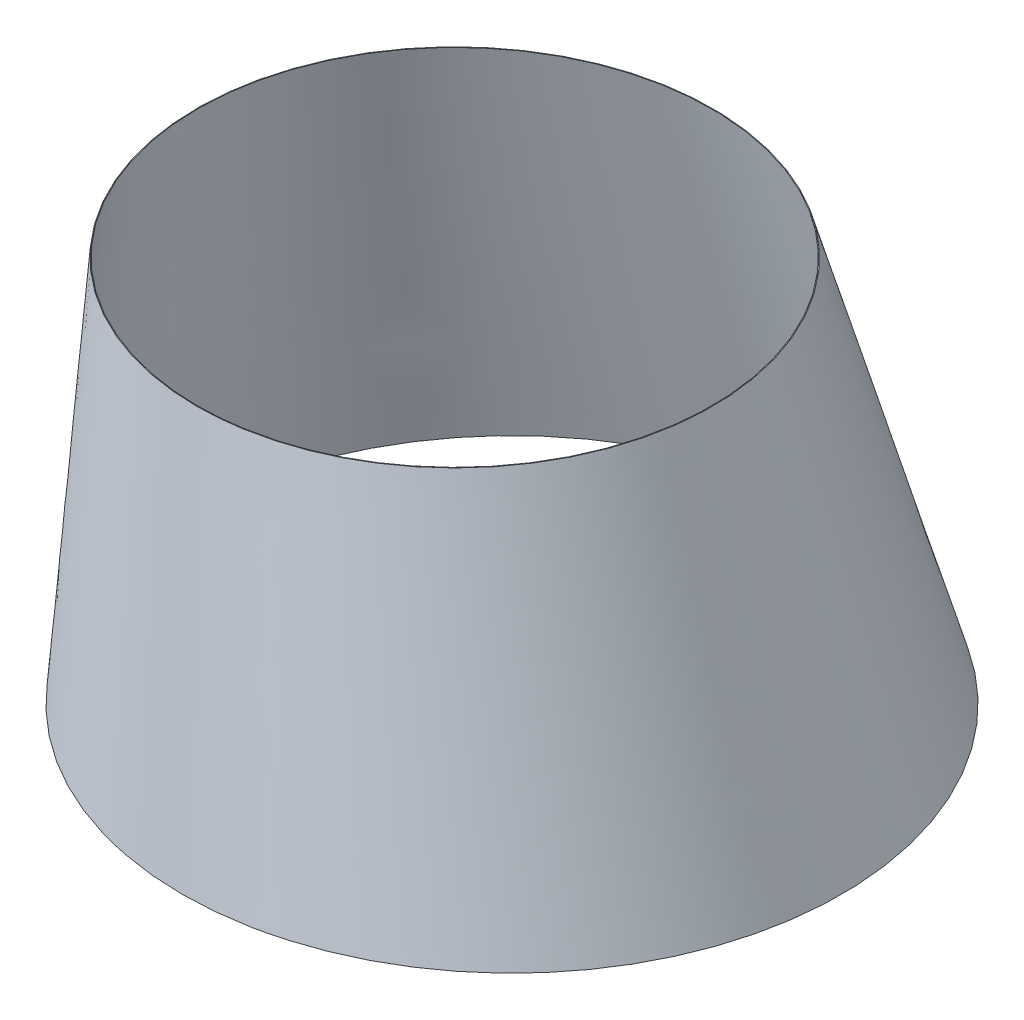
SolidWorks part; units mm, degrees
ref_plane "前视基准面" through (0, 0, 0) normal (0, 0, 1) x (1, 0, 0)
ref_plane "上视基准面" through (0, 0, 0) normal (0, 1, 0) x (1, 0, 0)
ref_plane "右视基准面" through (0, 0, 0) normal (1, 0, 0) x (0, 0, -1)
sketch "草图1" plane through (0, 0, 0) normal (0, 1, 0) x (1, 0, 0)
  line L0 (-460, 0) -> (460, 0) construction
  circle A0 centre (0, 0) radius 460
  dimension "D" = 920
sketch "草图2" plane through (0, 0, 0) normal (0, 0, 1) x (1, 0, 0)
  line L0 (-368, 2300) -> (-368, 0) construction
  line L1 (460, 0) -> (-368, 2300) construction
  line L2 (-368, 2300) -> (-460, 0) construction
  line L3 (-440, 500) -> (280, 500)
  line L4 (-80, 500) -> (-80, 0) construction
  line L5 (-460, 0) -> (460, 0) construction
  dimension "C" = 80
  dimension "d" = 720
  dimension "h" = 500
sketch "草图3" plane through (0, 0, 0) normal (0, 0, 1) x (1, 0, 0)
  point P0 (-368, 2300)
loft "放样1" add profiles "草图1", "草图3"
extrude "切除-拉伸1" cut sketch "草图2" against normal through all and the other way through all
shell "抽壳1"
